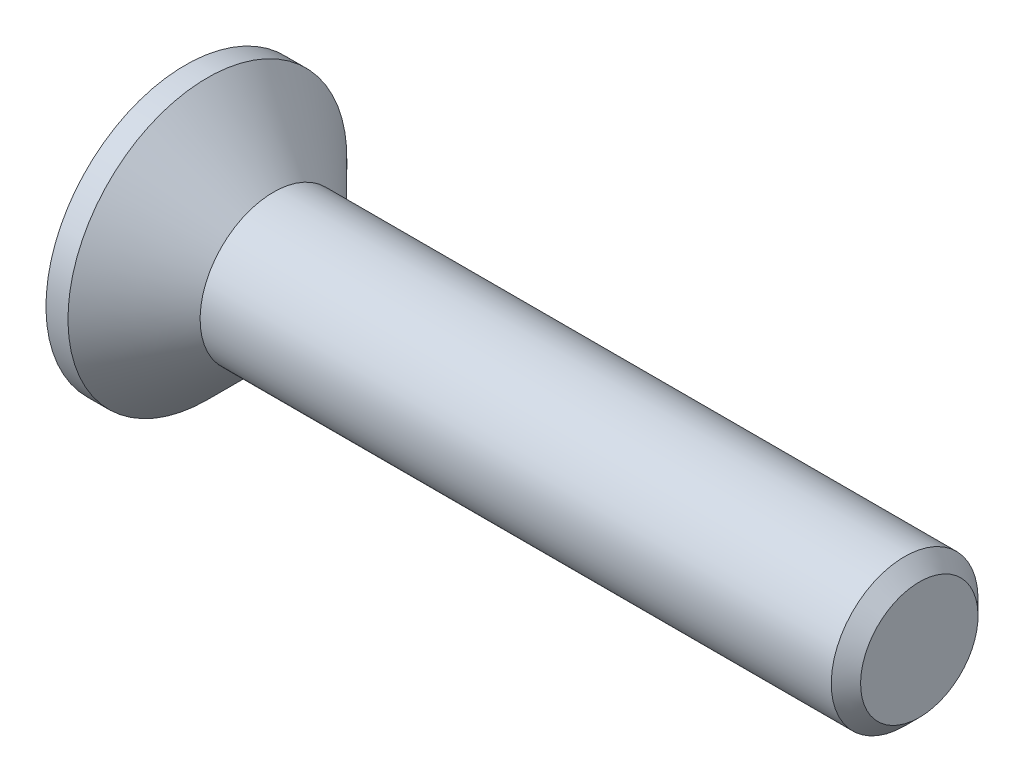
SolidWorks part; units mm, degrees
ref_plane "Front Plane" through (0, 0, 0) normal (0, 0, 1) x (1, 0, 0)
ref_plane "Top Plane" through (0, 0, 0) normal (0, 1, 0) x (1, 0, 0)
ref_plane "Right Plane" through (0, 0, 0) normal (1, 0, 0) x (0, 0, -1)
sketch "Sketch1" plane through (0, 0, 0) normal (0, 0, 1) x (1, 0, 0)
  line L1 (-1.2, 1.9) -> (-1.2, 0)
  line L2 (-1.2, 0) -> (8.8, 0)
  line L3 (8.8, 0) -> (8.8, 1)
  line L4 (8.8, 1) -> (0, 1)
  line L5 (-1.2, 1.9) -> (-0.9, 1.9)
  line L6 (-0.9, 1.9) -> (0, 1)
  dimension "D1" = 1
  dimension "D2" = 45
  dimension "D3" = 1.2
  dimension "D4" = 10
  dimension "D5" = 1.9
revolve "Revolve1" add sketch "Sketch1" angle 360 about L2
chamfer "Chamfer1" distance 0.2 angle 45 1 edges at (8.8, -1, 0)
sketch "Sketch2" plane through (-1.2, 0, 0) normal (-1, 0, 0) x (0, 0, 1)
  line L0 (-0.3, 1.175) -> (0.3, 1.175)
  line L1 (0.3, 1.175) -> (0.3, 0.3)
  line L2 (0.3, 0.3) -> (1.175, 0.3)
  line L3 (1.175, 0.3) -> (1.175, -0.3)
  line L4 (1.175, -0.3) -> (0.3, -0.3)
  line L5 (0.3, -0.3) -> (0.3, -1.175)
  line L6 (0.3, -1.175) -> (-0.3, -1.175)
  line L7 (-0.3, -1.175) -> (-0.3, -0.3)
  line L8 (-0.3, -0.3) -> (-1.175, -0.3)
  line L9 (-1.175, -0.3) -> (-1.175, 0.3)
  line L10 (-1.175, 0.3) -> (-0.3, 0.3)
  line L11 (-0.3, 0.3) -> (-0.3, 1.175)
  point P5 (0, 1.175)
  point P13 (1.175, 0)
  point P15 (-1.175, 0)
  point P16 (0, -1.175)
  point P17 (0.3, 1.085)
  dimension "D1" = 0.6
  dimension "D2" = 2.35
extrude "Cut-Extrude1" cut sketch "Sketch2" against normal blind 0.95
